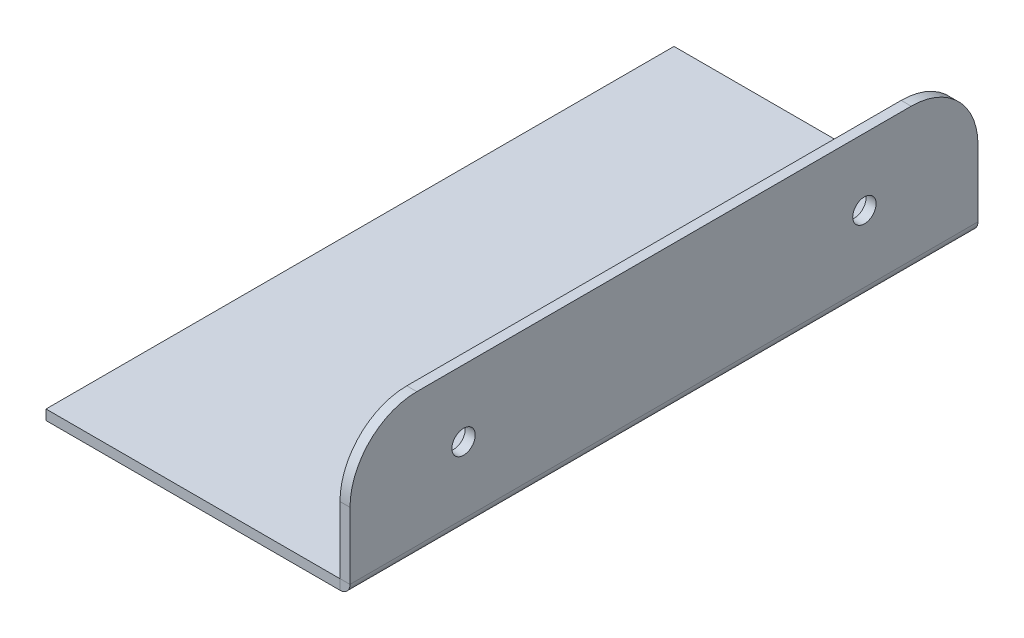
SolidWorks part; units mm, degrees
ref_plane "Front Plane" through (0, 0, 0) normal (0, 0, 1) x (1, 0, 0)
ref_plane "Top Plane" through (0, 0, 0) normal (0, 1, 0) x (1, 0, 0)
ref_plane "Right Plane" through (0, 0, 0) normal (1, 0, 0) x (0, 0, -1)
sketch "Sketch1" plane through (0, 0, 0) normal (0, 1, 0) x (1, 0, 0)
  line L0 (54, 84) -> (54, 10) construction
  line L1 (0, 0) -> (54, 0)
  line L2 (0, 0) -> (0, 94)
  line L3 (0, 94) -> (54, 94)
  line L4 (64, 10) -> (64, 84)
  line L5 (54, 17) -> (34, 17) construction
  line L6 (34, 17) -> (34, 77) construction
  line L7 (34, 77) -> (54, 77) construction
  line L8 (64, 47) -> (0, 47) construction
  arc A0 (64, 84) -> (54, 94) centre (54, 84) ccw
  arc A1 (54, 0) -> (64, 10) centre (54, 10) ccw
  circle A2 centre (54, 77) radius 1.75
  circle A3 centre (54, 17) radius 1.75
  circle A4 centre (34, 77) radius 1.75
  circle A5 centre (34, 17) radius 1.75
  dimension "D1" = 10
  dimension "D2" = 3.5
  dimension "D4" = 20
  dimension "D7" = 17
  dimension "D3" = 34
  dimension "D5" = 30
  dimension "D6" = 17
sheet metal parameters "Sheet-Metal1" thickness 1.5 parameters "D1"=1
base flange "Base-Flange1" sketch "Sketch1" thickness 1.5 reverse thickness direction yes parameters "D1"=1
sketch "Sketch3" plane through (0, 1.5, 0) normal (0, 1, 0) x (1, 0, 0)
  line L0 (44, 94) -> (44, 0)
  line L1 (54, 94) -> (0, 94) construction
  line L2 (0, 0) -> (54, 0) construction
  line L3 (64, 10) -> (64, 84) construction
  dimension "D1" = 20
sketched bend "Sketched Bend1" parameters "D1"=0.01
bend "SketchBend1" bend radius 0.01 bend angle 90 parameters "D5"=1
flat pattern "Flat-Pattern1"
sketch "Bend-Lines1" plane through (0, 0, 0) normal (0, 1, 0) x (-1, 0, 0)
bend of the flat pattern "Flatten-<SketchBend1>1"
